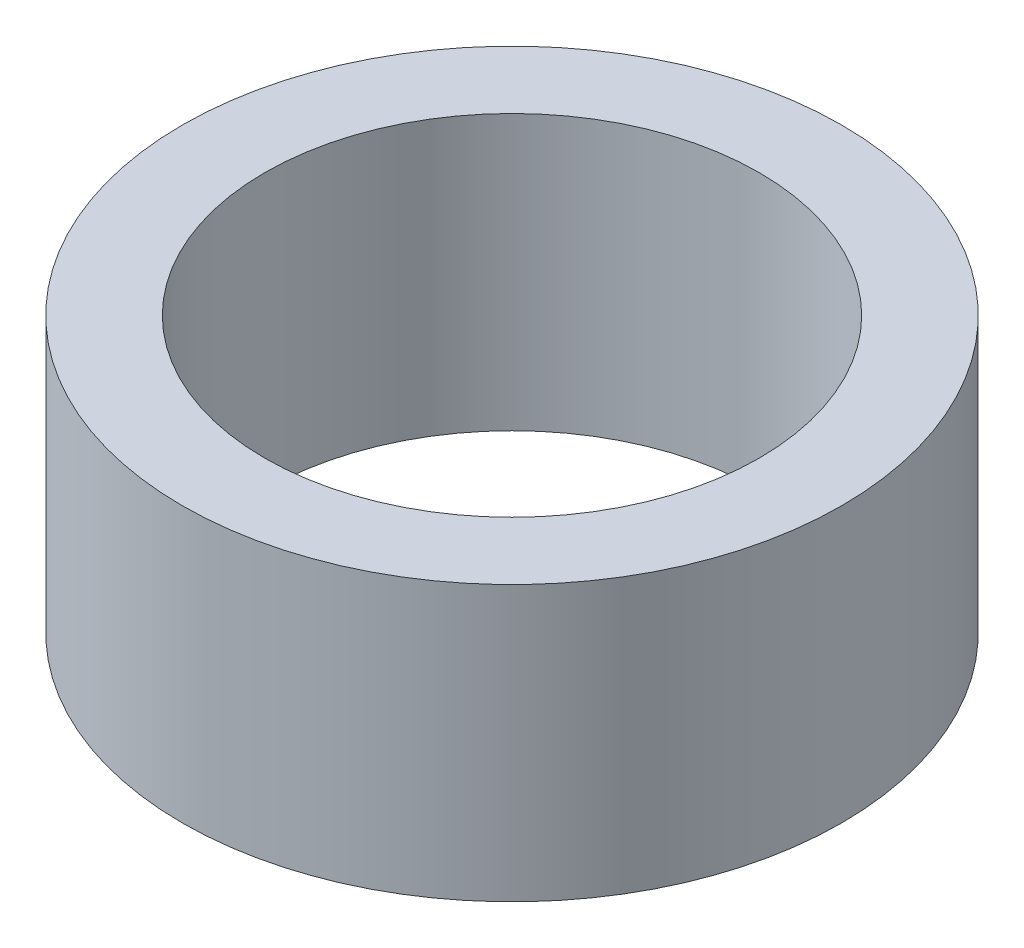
SolidWorks part; units mm, degrees
ref_plane "Face" through (0, 0, 0) normal (0, 0, 1) x (1, 0, 0)
ref_plane "Dessus" through (0, 0, 0) normal (0, 1, 0) x (1, 0, 0)
ref_plane "Droite" through (0, 0, 0) normal (1, 0, 0) x (0, 0, -1)
sketch "Esquisse1" plane through (0, 0, 0) normal (0, 0, 1) x (1, 0, 0)
  line L0 (0, 0) -> (0, 8.7548) construction
  line L2 (4.5, 0) -> (6, 0)
  line L3 (4.5, 0) -> (4.5, 5)
  line L4 (4.5, 5) -> (6, 5)
  line L5 (6, 0) -> (6, 5)
  dimension "D1" = 5
  dimension "D2" = 12
  dimension "D3" = 9
revolve "Révolution1" add sketch "Esquisse1" angle 360 about L0
